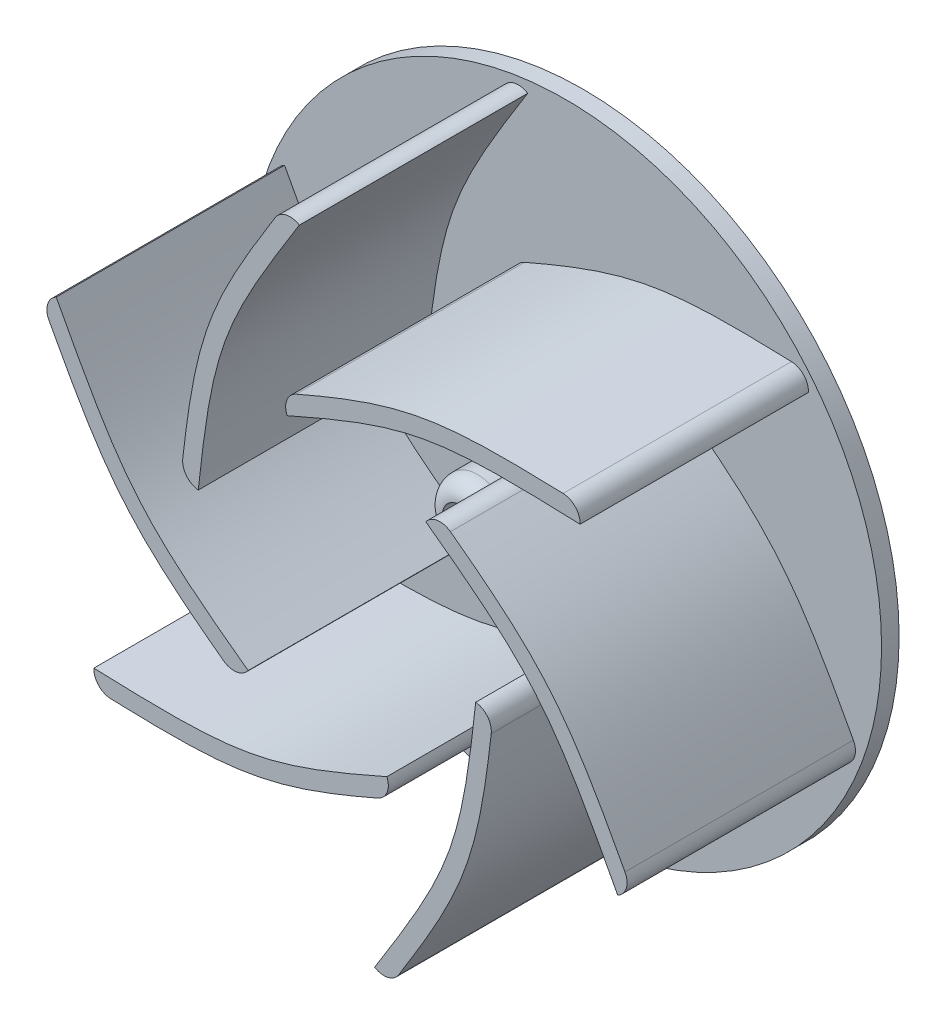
SolidWorks part; units mm, degrees
ref_plane "Front Plane" through (0, 0, 0) normal (0, 0, 1) x (1, 0, 0)
ref_plane "Top Plane" through (0, 0, 0) normal (0, 1, 0) x (1, 0, 0)
ref_plane "Right Plane" through (0, 0, 0) normal (1, 0, 0) x (0, 0, -1)
sketch "Sketch1" plane through (0, 0, 0) normal (0, 0, 1) x (1, 0, 0)
  circle A0 centre (0, 0) radius 18
  dimension "D1" = 36
extrude "Boss-Extrude1" add sketch "Sketch1" against normal blind 1
sketch "Sketch4" plane through (0, 0, 0) normal (0, 0, 1) x (1, 0, 0)
  circle A0 centre (0, 0) radius 1.1
  dimension "D1" = 2.2
extrude "Cut-Extrude1" cut sketch "Sketch4" against normal through all
sketch "Sketch6" plane through (0, 0, 0) normal (0, 0, 1) x (1, 0, 0)
  circle A0 centre (0, 0) radius 1
  circle A2 centre (0, 0) radius 2
  dimension "D1" = 2
  dimension "D2" = 4
extrude "Boss-Extrude3" add sketch "Sketch6" along normal blind 6
sketch "Sketch7" plane through (0, 0, 0) normal (0, 0, 1) x (1, 0, 0)
  line L0 (0, 0) -> (5.0585, 6.1977) construction
  line L2 (5.6481, 7.0054) -> (5.0585, 6.1977)
  line L3 (15.9844, -6.7532) -> (16.8675, -6.284)
  circle A3 centre (0, 0) radius 18 construction
  spline S0 degree 3 poles (5.0585, 6.1977) (11.2558, 1.673) (12.209, 0.3515) (15.9844, -6.7532) knots 0 0 0 0 0.864172 0.864172 0.864172 0.864172
  spline S1 degree 1 poles (5.6481, 7.0054) (16.8675, -6.284) knots 0 0 1 1 construction
  spline S2 degree 3 poles (5.6481, 7.0054) (5.8383, 6.8665) (6.2246, 6.5833) (6.9427, 6.0508) (7.7792, 5.4178) (8.6858, 4.7046) (9.7855, 3.7943) (10.9827, 2.6991) (12.2191, 1.3499) (13.3308, -0.1221) (14.2247, -1.5223) (14.9691, -2.7965) (15.5541, -3.842) (16.076, -4.8026) (16.5168, -5.625) (16.752, -6.0668) (16.8675, -6.284) knots 0 0 0 0 0.027005 0.054011 0.108021 0.162032 0.216043 0.324064 0.432086 0.540107 0.648129 0.70214 0.75615 0.810161 0.837166 0.864172 0.864172 0.864172 0.864172
  dimension "D1" = 8
  dimension "D2" = 1
extrude "Boss-Extrude5" add sketch "Sketch7" along normal blind 13
fillet "Fillet1" radius 1 1 edges at (5.6481, 7.0054, 6.5)
fillet "Fillet2" radius 1 1 edges at (16.8675, -6.284, 6.5)
pattern_circular "CirPattern3" count 6 over 360 about axis through (0, 0, 6) along (0, 0, 1) of "Fillet1", "Boss-Extrude5", "Fillet2"
fillet "Fillet4" radius 1 2 edges at (2, 0, 0) (2, 0, 6)
